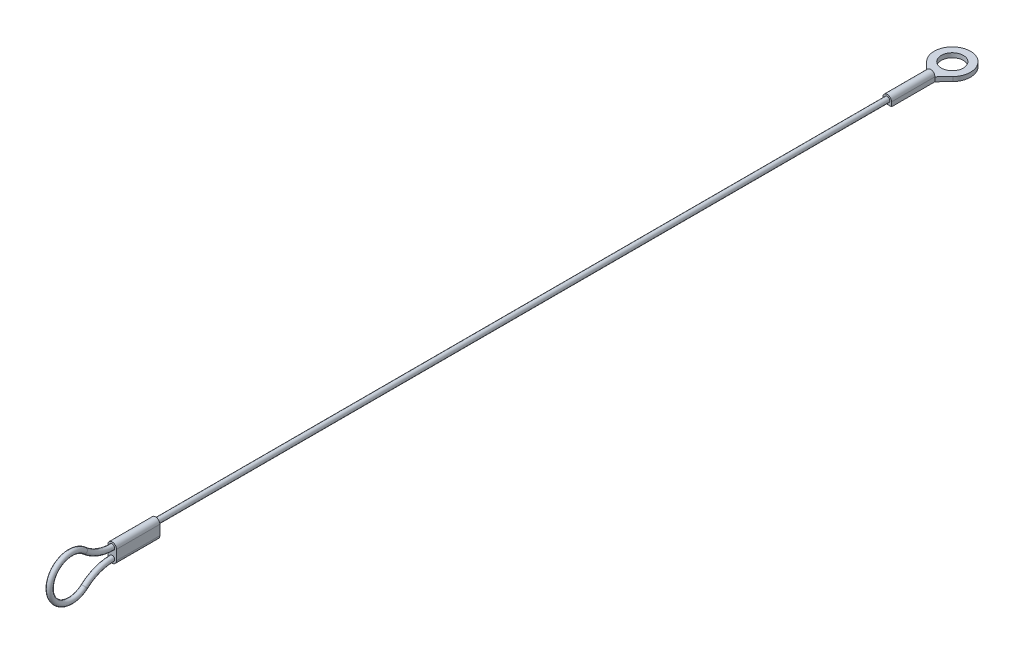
SolidWorks part; units mm, degrees
ref_plane "Front Plane" through (0, 0, 0) normal (0, 0, 1) x (1, 0, 0)
ref_plane "Top Plane" through (0, 0, 0) normal (0, 1, 0) x (1, 0, 0)
ref_plane "Right Plane" through (0, 0, 0) normal (1, 0, 0) x (0, 0, -1)
sketch "Sketch1" plane through (0, 0, 0) normal (1, 0, 0) x (0, 0, -1)
  line L2 (-178.6, 0) -> (0, 0)
  arc A0 (-178.6, 0) -> (-185, 2.4446) centre (-178.6, 9.6) cw
  arc A1 (-185, 2.4446) -> (-185, -4.7108) centre (-188.2, -1.1331) ccw
  arc A2 (-185, -4.7108) -> (-178.6, -2.2663) centre (-178.6, -11.8663) cw
  dimension "D1" = 4.8
  dimension "D4" = 9.6
  dimension "D2" = 188.2
  dimension "D3" = 9.6
sketch "Sketch2" plane through (0, 0, 0) normal (0, 0, 1) x (1, 0, 0)
  circle A0 centre (0, 0) radius 0.595
  dimension "D1" = 1.19
sweep "Sweep1" add profiles "Sketch2" path "Sketch1"
sketch "Sketch3" plane through (0, 0, 178.6) normal (0, 0, -1) x (-1, 0, 0)
  line L0 (0, 0) -> (0, -2.2663) construction
  line L1 (0.995, 0) -> (0.995, -2.2663)
  line L2 (-0.995, 0) -> (-0.995, -2.2663)
  line L3 (-0.595, -2.2663) -> (0.595, -2.2663) construction
  arc A0 (0.995, 0) -> (-0.995, 0) centre (0, 0) ccw
  arc A1 (-0.995, -2.2663) -> (0.995, -2.2663) centre (0, -2.2663) ccw
  point P3 (0, -1.1331)
  dimension "D1" = 1.99
extrude "Boss-Extrude1" add sketch "Sketch3" along normal blind 10
sketch "Sketch4" plane through (0, 0, 0) normal (0, 0, -1) x (-1, 0, 0)
  line L0 (-0.995, 0) -> (-0.995, -0.995)
  line L1 (-0.995, -0.995) -> (0, -0.995)
  line L2 (0, -0.995) -> (0.995, -0.995)
  line L3 (0.995, -0.995) -> (0.995, 0)
  arc A0 (0.995, 0) -> (-0.995, 0) centre (0, 0) ccw
  dimension "D1" = 1.99
extrude "Boss-Extrude2" add sketch "Sketch4" along normal blind 10
sketch "Sketch5" plane through (0, -0.995, 0) normal (0, -1, 0) x (1, 0, 0)
  line L0 (-0.995, -10) -> (0.995, -10)
  line L1 (0.995, -10) -> (3.0131, -12.0884)
  line L2 (-3.0131, -12.0884) -> (-0.995, -10)
  arc A0 (3.0131, -12.0884) -> (-3.0131, -12.0884) centre (0, -15) cw
  circle A1 centre (0, -15) radius 2.54
  point P8 (-4.19, -15)
  point P9 (4.19, -15)
  dimension "D1" = 5.08
  dimension "D2" = 8.38
  dimension "D3" = 15
extrude "Boss-Extrude3" add sketch "Sketch5" against normal blind 1.01
